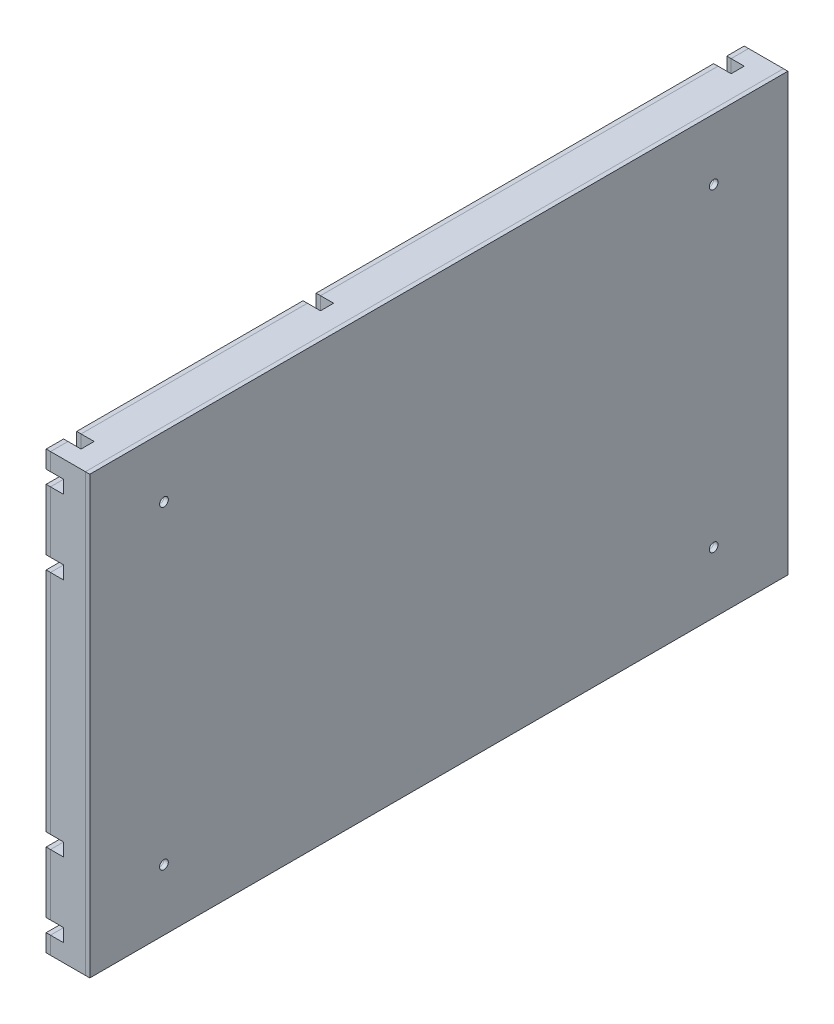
SolidWorks part; units mm, degrees
ref_plane "Plan de face" through (0, 0, 0) normal (0, 0, 1) x (1, 0, 0)
ref_plane "Plan de dessus" through (0, 0, 0) normal (0, 1, 0) x (1, 0, 0)
ref_plane "Plan de droite" through (0, 0, 0) normal (1, 0, 0) x (0, 0, -1)
sketch "Esquisse1" plane through (0, 0, 0) normal (1, 0, 0) x (0, 0, -1)
  line L1 (0, 0) -> (160, 0)
  line L2 (0, 0) -> (0, 100)
  line L3 (0, 100) -> (160, 100)
  line L4 (160, 0) -> (160, 100)
  dimension "D1" = 160
  dimension "D2" = 100
extrude "Extrusion1" add sketch "Esquisse1" along normal blind 1
sketch "Esquisse2" plane through (1, 0, 0) normal (-1, 0, 0) x (0, 0, 1)
  line L1 (-160, 100) -> (0, 100)
  line L2 (-160, 100) -> (-160, 0)
  line L3 (-160, 0) -> (0, 0)
  line L4 (0, 100) -> (0, 0)
extrude "Extrusion4" add sketch "Esquisse2" against normal blind 8 separate body
sketch "Esquisse4" plane through (9, 0, 0) normal (1, 0, 0) x (0, 0, -1)
  line L1 (0, 100) -> (160, 100)
  line L2 (0, 100) -> (0, 0)
  line L3 (0, 0) -> (160, 0)
  line L4 (160, 100) -> (160, 0)
extrude "Extrusion5" add sketch "Esquisse4" along normal blind 1 separate body
sketch "Esquisse5" plane through (0, 0, 0) normal (1, 0, 0) x (0, 0, -1)
  line L0 (160, 0) -> (160, 100) construction
  line L1 (156, 108.4085) -> (153, 108.4085)
  line L2 (156, 108.4085) -> (156, -9.5945)
  line L3 (156, -9.5945) -> (153, -9.5945)
  line L4 (153, 108.4085) -> (153, -9.5945)
  line L5 (0, 100) -> (0, 0) construction
  line L10 (7, 107.0249) -> (4, 107.0249)
  line L11 (7, 107.0249) -> (7, -7.0249)
  line L12 (7, -7.0249) -> (4, -7.0249)
  line L13 (4, 107.0249) -> (4, -7.0249)
  line L14 (0, 0) -> (160, 0) construction
  line L15 (81, 78) -> (78, 78)
  line L16 (81, 78) -> (81, -9.5945)
  line L17 (81, -9.5945) -> (78, -9.5945)
  line L18 (78, 78) -> (78, -9.5945)
  dimension "D1" = 3
  dimension "D2" = 4
  dimension "D4" = 3
  dimension "D5" = 4
  dimension "D7" = 3
  dimension "D8" = 79
  dimension "D9" = 78
extrude "Enlèv. mat.-Extru.1" cut sketch "Esquisse5" along normal blind 4
sketch "Esquisse6" plane through (0, 0, 0) normal (1, 0, 0) x (0, 0, -1)
  line L0 (153, 100) -> (7, 100) construction
  line L1 (165.6856, 96) -> (-8.2552, 96)
  line L2 (165.6856, 96) -> (165.6856, 93)
  line L3 (165.6856, 93) -> (-8.2552, 93)
  line L4 (-8.2552, 96) -> (-8.2552, 93)
  line L6 (164.4997, 79) -> (-14.778, 79)
  line L7 (164.4997, 79) -> (164.4997, 76)
  line L8 (164.4997, 76) -> (-14.778, 76)
  line L9 (-14.778, 79) -> (-14.778, 76)
  line L10 (168.0576, 4) -> (-9.6388, 4)
  line L11 (168.0576, 4) -> (168.0576, 7)
  line L12 (168.0576, 7) -> (-9.6388, 7)
  line L13 (-9.6388, 4) -> (-9.6388, 7)
  line L14 (7, 0) -> (78, 0) construction
  line L16 (165.6856, 24) -> (-9.6388, 24)
  line L17 (165.6856, 24) -> (165.6856, 21)
  line L18 (165.6856, 21) -> (-9.6388, 21)
  line L19 (-9.6388, 24) -> (-9.6388, 21)
  dimension "D1" = 3
  dimension "D2" = 4
  dimension "D3" = 21
  dimension "D4" = 3
  dimension "D5" = 3
  dimension "D6" = 4
  dimension "D7" = 3
  dimension "D8" = 21
extrude "Enlèv. mat.-Extru.3" cut sketch "Esquisse6" along normal blind 4
sketch "Esquisse7" plane through (0, 0, 0) normal (1, 0, 0) x (0, 0, -1)
  line L0 (125.3383, 0) -> (153, 76)
  line L1 (81, 0) -> (153, 0) construction
  line L2 (153, 76) -> (153, 24) construction
  line L3 (153.9311, 69.7867) -> (128.2731, -0.708)
  line L5 (128.2731, -0.708) -> (125.3383, 0)
  line L6 (153, 76) -> (153.9311, 69.7867)
  line L7 (81, 24) -> (99.9265, 76)
  line L8 (81, 76) -> (153, 76) construction
  line L9 (81, 24) -> (81, 76) construction
  line L10 (97.398, 77.8245) -> (68.7961, -0.7586)
  line L11 (81, 24) -> (72.2647, 0)
  line L12 (7, 0) -> (78, 0) construction
  line L13 (78, 21) -> (78, 7) construction
  line L14 (97.398, 77.8245) -> (99.9265, 76)
  line L15 (68.7961, -0.7586) -> (72.2647, 0)
  dimension "D1" = 20
  dimension "D2" = 3
  dimension "D3" = 20
  dimension "D4" = 3
  dimension "D5" = 20
extrude "Enlèv. mat.-Extru.4" cut sketch "Esquisse7" along normal blind 4
sketch "Esquisse8" plane through (0, 0, 0) normal (1, 0, 0) x (0, 0, -1)
  line L0 (58.881, 76) -> (86.5428, 0)
  line L1 (7, 76) -> (78, 76) construction
  line L3 (58.881, 76) -> (58.881, 105.2122)
  line L4 (81, 0) -> (125.3383, 0) construction
  line L6 (61.881, 76.529) -> (91.7572, -5.5553)
  line L7 (58.881, 105.2122) -> (61.881, 105.2122)
  line L9 (61.881, 105.2122) -> (61.881, 76.529)
  line L11 (91.7572, -5.5553) -> (86.5428, 0)
  dimension "D4" = 3
extrude "Enlèv. mat.-Extru.5" cut sketch "Esquisse8" along normal blind 4
sketch "Esquisse9" plane through (0, 0, 0) normal (1, 0, 0) x (0, 0, -1)
  line L0 (160, 79) -> (160, 93) construction
  line L1 (153, 100) -> (61.881, 100) construction
  line L2 (160, 50) -> (0, 50) construction
  line L3 (160, 24) -> (160, 76) construction
  line L4 (0, 76) -> (0, 24) construction
  line L5 (0, 93) -> (0, 79) construction
  circle A0 centre (143, 86) radius 1
  circle A1 centre (17, 86) radius 1
  circle A2 centre (17, 14) radius 1
  circle A3 centre (143, 14) radius 1
  dimension "D1" = 17
  dimension "D3" = 2
  dimension "D2" = 14
  dimension "D4" = 17
extrude "Enlèv. mat.-Extru.6" cut sketch "Esquisse9" along normal through all
